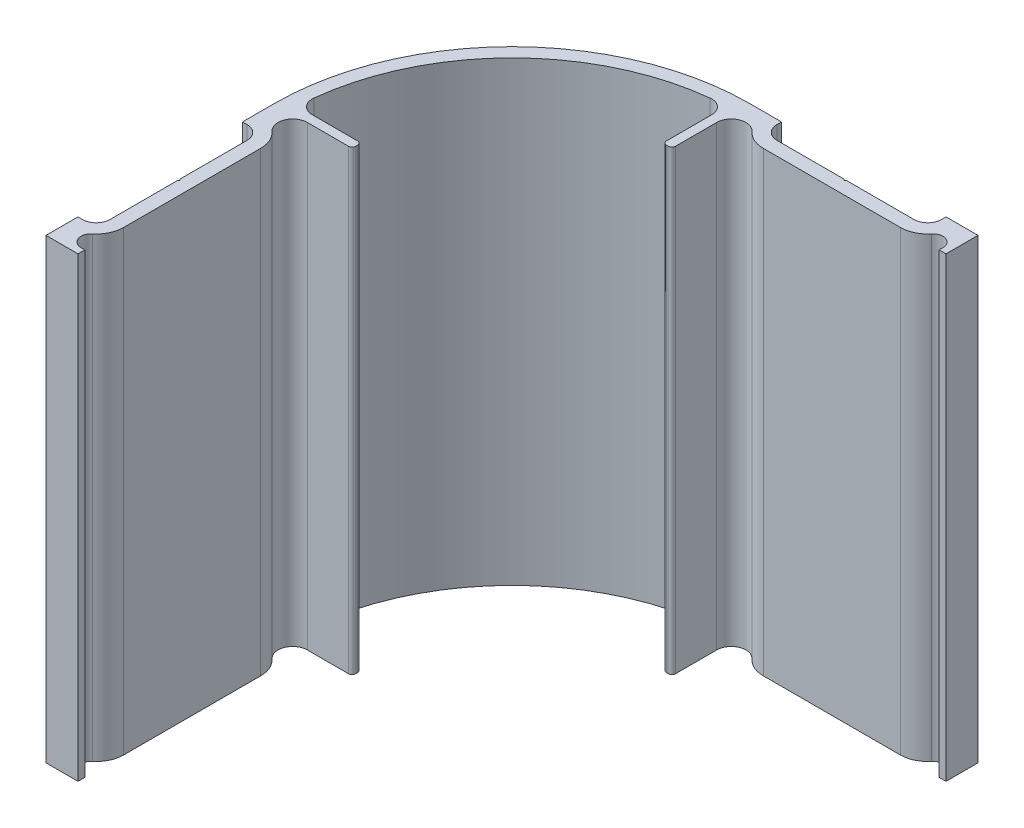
SolidWorks part; units mm, degrees
ref_plane "Front Plane" through (0, 0, 0) normal (0, 0, 1) x (1, 0, 0)
ref_plane "Top Plane" through (0, 0, 0) normal (0, 1, 0) x (1, 0, 0)
ref_plane "Right Plane" through (0, 0, 0) normal (1, 0, 0) x (0, 0, -1)
sketch "Sketch1" plane through (0, 0, 0) normal (0, 1, 0) x (1, 0, 0)
  line L0 (98.6606, 102.0031) -> (105.6606, 102.0031)
  line L1 (105.6606, 102.0031) -> (105.6606, 95.0031)
  line L2 (105.6606, 95.0031) -> (104.1606, 95.0031)
  line L3 (104.1606, 95.0031) -> (104.1606, 95.8305)
  line L4 (98.6606, 102.0031) -> (98.6606, 101.0031)
  line L5 (80.3606, 98.0031) -> (80.6606, 97.7031)
  line L6 (80.6606, 97.7031) -> (80.9606, 98.0031)
  line L7 (80.9606, 98.0031) -> (95.6606, 98.0031)
  line L8 (80.3606, 98.0031) -> (65.6606, 98.0031)
  line L9 (95.6606, 95.0031) -> (80.6606, 95.0031)
  line L10 (55.6606, 102.0031) -> (62.6606, 102.0031)
  line L11 (62.6606, 101.0031) -> (62.6606, 102.0031)
  line L12 (80.6606, 95.0031) -> (65.6606, 95.0031)
  line L13 (55.6606, 94.8122) -> (55.6606, 85.8031)
  line L14 (54.8606, 85.0031) -> (54.4606, 85.0031)
  line L15 (53.6606, 85.8031) -> (53.6606, 95.7306)
  line L16 (3.6606, 0.0031) -> (3.6606, 7.0031)
  line L17 (10.6606, 0.0031) -> (3.6606, 0.0031)
  line L18 (10.6606, 1.5031) -> (10.6606, 0.0031)
  line L19 (9.8333, 1.5031) -> (10.6606, 1.5031)
  line L20 (4.6606, 7.0031) -> (3.6606, 7.0031)
  line L21 (7.9606, 25.0031) -> (7.6606, 25.3031)
  line L22 (7.6606, 24.7031) -> (7.9606, 25.0031)
  line L23 (7.6606, 10.0031) -> (7.6606, 24.7031)
  line L24 (7.6606, 40.0031) -> (7.6606, 25.3031)
  line L25 (10.6606, 25.0031) -> (10.6606, 10.0031)
  line L26 (3.6606, 43.0031) -> (3.6606, 50.0031)
  line L27 (3.6606, 43.0031) -> (4.6606, 43.0031)
  line L28 (10.6606, 40.0031) -> (10.6606, 25.0031)
  line L29 (19.8606, 50.0031) -> (10.8515, 50.0031)
  line L30 (20.6606, 51.2031) -> (20.6606, 50.8031)
  line L31 (9.9332, 52.0031) -> (19.8606, 52.0031)
  arc A0 (104.1606, 95.8305) -> (100.3059, 97.2056) centre (101.988, 95.8305) ccw
  arc A1 (95.6606, 95.0031) -> (100.3059, 97.2056) centre (95.6606, 101.0031) ccw
  arc A2 (95.6606, 98.0031) -> (98.6606, 101.0031) centre (95.6606, 101.0031) ccw
  arc A3 (61.2233, 96.9646) -> (65.6606, 95.0031) centre (65.6606, 101.0031) ccw
  arc A4 (62.6606, 101.0031) -> (65.6606, 98.0031) centre (65.6606, 101.0031) ccw
  arc A5 (61.2233, 96.9646) -> (55.6606, 94.8122) centre (58.8584, 94.8122) ccw
  arc A6 (55.6606, 102.0031) -> (18.8911, 86.7727) centre (55.6606, 50.0031) ccw
  arc A7 (50.3346, 98.7128) -> (21.0124, 84.6513) centre (55.6606, 50.0031) ccw
  arc A8 (8.4582, 5.3578) -> (9.8333, 1.5031) centre (9.8333, 3.6757) ccw
  arc A9 (8.4582, 5.3578) -> (10.6606, 10.0031) centre (4.6606, 10.0031) ccw
  arc A10 (4.6606, 7.0031) -> (7.6606, 10.0031) centre (4.6606, 10.0031) ccw
  arc A11 (10.6606, 40.0031) -> (8.6992, 44.4405) centre (4.6606, 40.0031) ccw
  arc A12 (7.6606, 40.0031) -> (4.6606, 43.0031) centre (4.6606, 40.0031) ccw
  arc A13 (10.8515, 50.0031) -> (8.6992, 44.4405) centre (10.8515, 46.8054) ccw
  arc A14 (18.8911, 86.7727) -> (3.6606, 50.0031) centre (55.6606, 50.0031) ccw
  arc A15 (21.0124, 84.6513) -> (6.951, 55.3292) centre (55.6606, 50.0031) ccw
  arc A16 (53.6606, 95.7306) -> (50.3346, 98.7128) centre (50.6606, 95.7306) ccw
  arc A17 (53.6606, 85.8031) -> (54.4606, 85.0031) centre (54.4606, 85.8031) ccw
  arc A18 (54.8606, 85.0031) -> (55.6606, 85.8031) centre (54.8606, 85.8031) ccw
  arc A19 (6.951, 55.3292) -> (9.9332, 52.0031) centre (9.9332, 55.0031) ccw
  arc A20 (20.6606, 51.2031) -> (19.8606, 52.0031) centre (19.8606, 51.2031) ccw
  arc A21 (19.8606, 50.0031) -> (20.6606, 50.8031) centre (19.8606, 50.8031) ccw
  dimension "D1" = 52
extrude "Extrude1" add sketch "Sketch1" along normal mid plane 100
